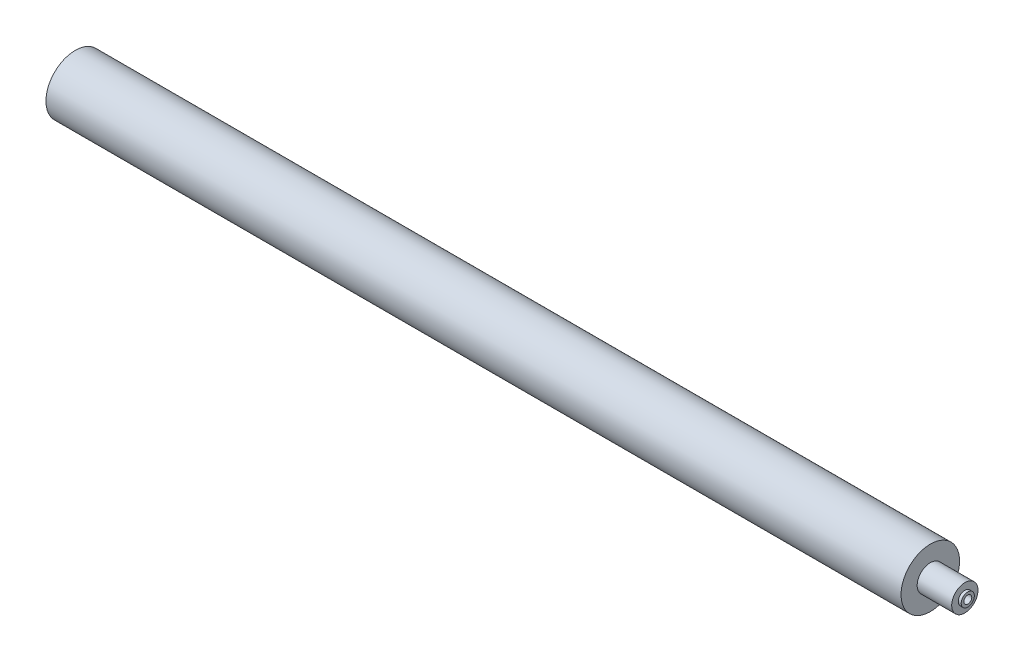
SolidWorks part; units mm, degrees
ref_plane "Plan de face" through (0, 0, 0) normal (0, 0, 1) x (1, 0, 0)
ref_plane "Plan de dessus" through (0, 0, 0) normal (0, 1, 0) x (1, 0, 0)
ref_plane "Plan de droite" through (0, 0, 0) normal (1, 0, 0) x (0, 0, -1)
sketch "Esquisse1" plane through (0, 0, 0) normal (1, 0, 0) x (0, 0, -1)
  circle A0 centre (0, 0) radius 44.5
  dimension "D1" = 89
extrude "Extrusion1" add sketch "Esquisse1" along normal blind 1300
sketch "Esquisse2" plane through (0, 0, 0) normal (-1, 0, 0) x (0, 0, 1)
  circle A0 centre (0, 0) radius 10
  dimension "D1" = 20
extrude "Extrusion2" add sketch "Esquisse2" along normal blind 3
sketch "Esquisse8" plane through (1300, 0, 0) normal (1, 0, 0) x (0, 0, -1)
  circle A0 centre (0, 0) radius 20
extrude "Extrusion5" add sketch "Esquisse8" along normal blind 52.5
sketch "Esquisse9" plane through (1352.5, 0, 0) normal (1, 0, 0) x (0, 0, -1)
  circle A0 centre (0, 0) radius 10
extrude "Extrusion6" add sketch "Esquisse9" along normal blind 4.5
sketch "Esquisse11" plane through (-3, 0, 0) normal (-1, 0, 0) x (0, 0, 1)
  circle A0 centre (0, 0) radius 6
extrude "Enlèv. mat.-Extru.2" cut sketch "Esquisse11" against normal blind 30
sketch "Esquisse12" plane through (1357, 0, 0) normal (1, 0, 0) x (0, 0, -1)
  circle A0 centre (0, 0) radius 6
extrude "Enlèv. mat.-Extru.3" cut sketch "Esquisse12" against normal blind 30
